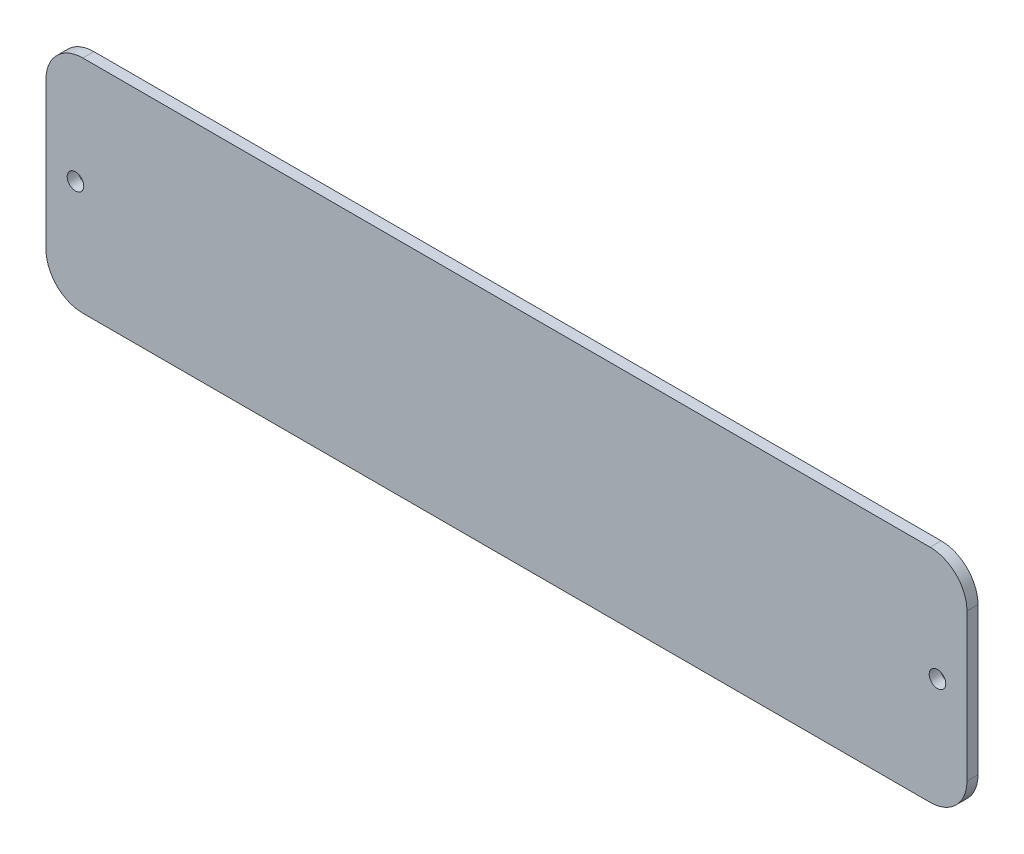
SolidWorks part; units mm, degrees
ref_plane "Face" through (0, 0, 0) normal (0, 0, 1) x (1, 0, 0)
ref_plane "Dessus" through (0, 0, 0) normal (0, 1, 0) x (1, 0, 0)
ref_plane "Droite" through (0, 0, 0) normal (1, 0, 0) x (0, 0, -1)
sketch "Esquisse1" plane through (0, 0, 0) normal (0, 0, 1) x (1, 0, 0)
  line L1 (20, 0) -> (480, 0)
  line L2 (0, -20) -> (0, -100)
  line L3 (20, -120) -> (480, -120)
  line L4 (500, -20) -> (500, -100)
  arc A0 (0, -20) -> (20, 0) centre (20, -20) cw
  arc A1 (20, -120) -> (0, -100) centre (20, -100) cw
  arc A2 (500, -20) -> (480, 0) centre (480, -20) ccw
  arc A3 (500, -100) -> (480, -120) centre (480, -100) cw
  circle A4 centre (484, -60) radius 4.5
  circle A5 centre (16, -60) radius 4.5
  point P7 (0, 0)
  point P10 (0, -120)
  point P13 (500, 0)
  dimension "D3" = 20
  dimension "D4" = 9
  dimension "D1" = 500
  dimension "D2" = 120
  dimension "D5" = 60
  dimension "D6" = 16
  dimension "D7" = 484
extrude "Base-Extrusion" add sketch "Esquisse1" along normal blind 6
